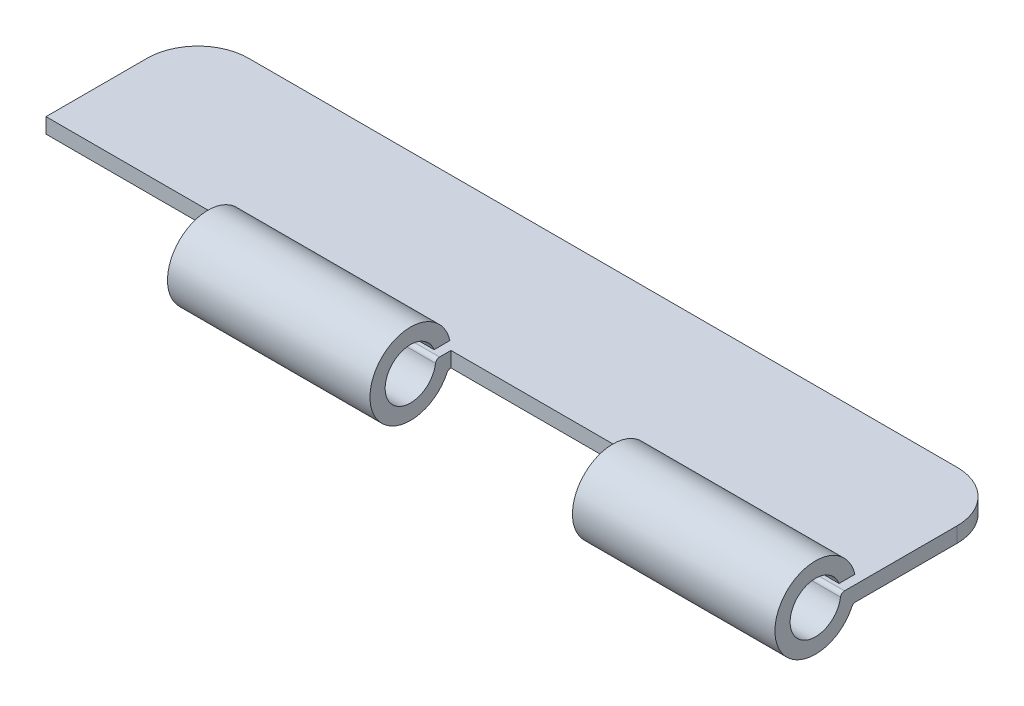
SolidWorks part; units mm, degrees
ref_plane "Front Plane" through (0, 0, 0) normal (0, 0, 1) x (1, 0, 0)
ref_plane "Top Plane" through (0, 0, 0) normal (0, 1, 0) x (1, 0, 0)
ref_plane "Right Plane" through (0, 0, 0) normal (1, 0, 0) x (0, 0, -1)
sketch "Sketch1" plane through (0, 0, 0) normal (0, 1, 0) x (1, 0, 0)
  line L1 (-40, -17.5) -> (40, -17.5)
  line L2 (-40, -17.5) -> (-40, -7.5)
  line L3 (-35, -2.5) -> (35, -2.5)
  line L4 (40, -17.5) -> (40, -7.5)
  line L5 (-40, -17.5) -> (40, 17.5) construction
  line L6 (-40, 17.5) -> (40, -17.5) construction
  arc A0 (35, -2.5) -> (40, -7.5) centre (35, -7.5) cw
  arc A1 (-40, -7.5) -> (-35, -2.5) centre (-35, -7.5) cw
  point P0 (0, 0)
  dimension "D1" = 5
  dimension "D2" = 10
extrude "Boss-Extrude1" add sketch "Sketch1" along normal blind 1.5
sketch "Sketch2" plane through (40, 0, 0) normal (1, 0, 0) x (0, 0, -1)
  line L0 (-17.6018, 2.3968) -> (-19.1664, 2.3968)
  line L1 (-17.5, 1.5) -> (-18.6277, 1.5)
  line L2 (-17.5314, 0) -> (-17.5, 0)
  line L3 (-17.5, 0) -> (-17.5, 1.5)
  arc A0 (-17.6018, 2.3968) -> (-17.8922, -0.2273) centre (-21.5, 1.5) ccw
  arc A1 (-19.1664, 2.3968) -> (-19.0239, 1.1552) centre (-21.5, 1.5) ccw
  arc A2 (-17.5314, 0) -> (-17.8922, -0.2273) centre (-17.5314, -0.4) ccw
  arc A3 (-18.6277, 1.5) -> (-19.0239, 1.1552) centre (-18.6277, 1.1) ccw
  dimension "D1" = 8
  dimension "D2" = 5
  dimension "D3" = 0.4
extrude "Boss-Extrude2" add sketch "Sketch2" against normal blind 20
pattern_linear "LPattern1" count 2 spacing 40 along (-1, 0, 0) of "Boss-Extrude2"
